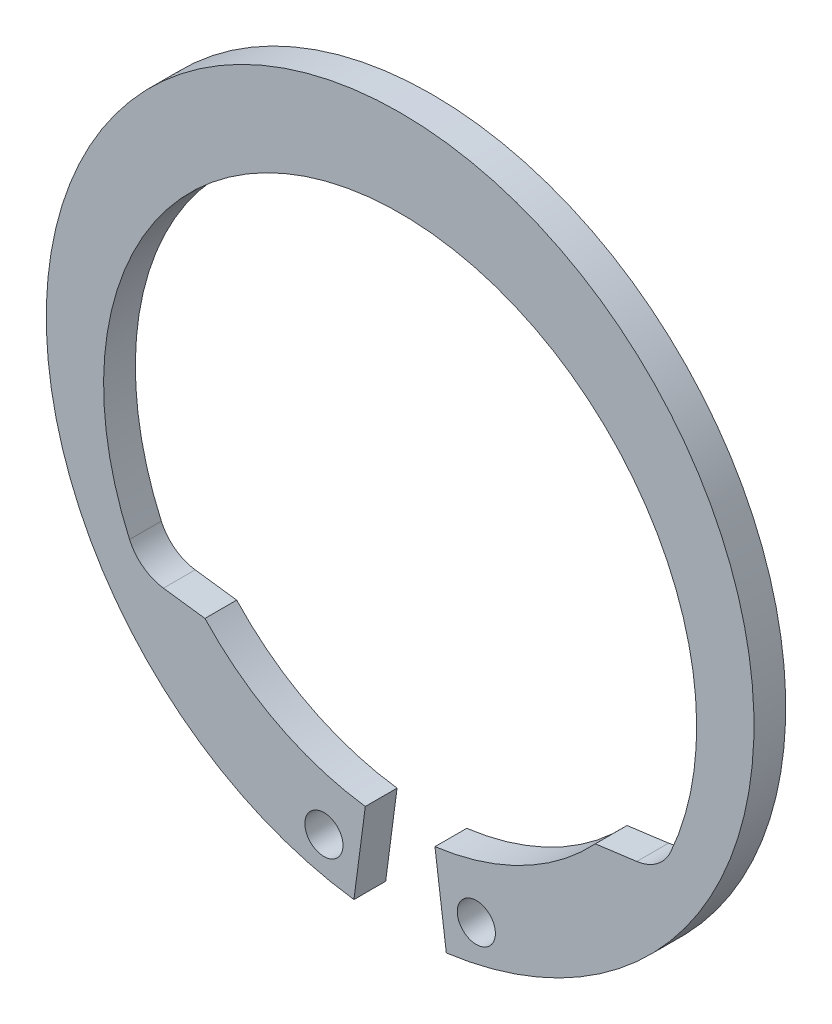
SolidWorks part; units mm, degrees
ref_plane "Plane1" through (0, 0, 0) normal (0, 0, 1) x (1, 0, 0)
ref_plane "Plane2" through (0, 0, 0) normal (0, 1, 0) x (1, 0, 0)
ref_plane "Plane3" through (0, 0, 0) normal (1, 0, 0) x (0, 0, -1)
sketch "Clipboard" plane through (0, 0, 0) normal (0, 0, 1) x (1, 0, 0)
  line L0 (0, 0) -> (1.7272, 0)
  line L1 (0, 0) -> (0, 1.2192)
  line L2 (0, 0) -> (0, -2.4384)
  circle A0 centre (0, 0) radius 0.5334
  circle A1 centre (0, 0) radius 7.9375
  dimension "HoleDia" = 1.0668
  dimension "ShaftDia" = 15.875
  dimension "SmallSection" = 1.2192
  dimension "LugSection" = 2.4384
sketch "BodySke" plane through (0, 0, 0) normal (0, 0, 1) x (1, 0, 0)
  line L0 (0, 0) -> (0, 11.176) construction
  line L1 (-0.9747, -7.4037) -> (-1.293, -9.8213)
  line L2 (0.9747, -7.4037) -> (1.293, -9.8213)
  line L3 (0, 0) -> (-7.523, -4.3434) construction
  line L4 (0, 0) -> (7.523, -4.3434) construction
  line L5 (6.6256, -4.9372) -> (5.464, -5.0901)
  line L6 (-6.6256, -4.9372) -> (-5.464, -5.0901)
  line L7 (1.942, -7.2107) -> (2.2624, -9.6442) construction
  line L8 (-1.942, -7.2107) -> (-2.2624, -9.6442) construction
  arc A0 (0.9747, -7.4037) -> (5.464, -5.0901) centre (0, 0) ccw
  arc A1 (7.5747, -4.2304) -> (-7.5747, -4.2304) centre (0, -0.8338) ccw
  arc A2 (-5.464, -5.0901) -> (-0.9747, -7.4037) centre (0, 0) ccw
  arc A3 (6.6256, -4.9372) -> (7.5747, -4.2304) centre (6.4671, -3.7338) ccw
  arc A4 (-7.5747, -4.2304) -> (-6.6256, -4.9372) centre (-6.4671, -3.7338) ccw
  arc A5 (0.9747, -7.4037) -> (-0.9747, -7.4037) centre (0, 0) ccw construction
  arc A6 (7.523, -4.3434) -> (-7.523, -4.3434) centre (0, -0.8338) ccw construction
  arc A7 (1.1645, -8.8454) -> (-1.1645, -8.8454) centre (0, 0) ccw construction
  arc A8 (1.293, -9.8213) -> (-1.293, -9.8213) centre (0, 0) ccw
  circle A9 centre (2.1332, -8.663) radius 0.5334
  circle A10 centre (-2.1332, -8.663) radius 0.5334
  dimension "D1" = 120
  dimension "GrooveDia" = 14.9352
  dimension "OutsideDia" = 19.812
  dimension "HoleOffsetRad" = 8.9217
  dimension "HoleDia" = 1.0668
  dimension "SmallRad" = 8.6868
  dimension "GapAngle" = 15
  dimension "HoleOffset" = 0.9843
extrude "Body" add sketch "BodySke" against normal blind 0.889
equation "' \"ShaftDia@Clipboard\" = 0.5"
equation "' \"Thickness@Body\" = 0.035"
equation "' \"GrooveDia@BodySke\" = 0.468"
equation "' \"LugSection@Clipboard\" = 0.08"
equation "' \"SmallSection@Clipboard\" = 0.041"
equation "' \"HoleDia@Clipboard\" = 0.042"
equation "' \"ShaftDia@Clipboard\" = 0.625"
equation "' \"GrooveDia@BodySke\" = 0.588"
equation "' \"LugSection@Clipboard\" = 0.096"
equation "' \"SmallSection@Clipboard\" = 0.048"
equation "\"OutsideDia@BodySke\" = \"GrooveDia@BodySke\" + \"LugSection@Clipboard\" * 2"
equation "\"SmallRad@BodySke\" =  \"GrooveDia@BodySke\" / 2 +  \"SmallSection@Clipboard\""
equation "\"HoleOffsetRad@BodySke\" = ( \"OutsideDia@BodySke\" + \"ShaftDia@Clipboard\" ) / 4"
equation "\"HoleOffset@BodySke\" = \"OutsideDia@BodySke\" / 2 - \"HoleOffsetRad@BodySke\" "
equation "\"HoleDia@BodySke\" = \"HoleDia@Clipboard\""
